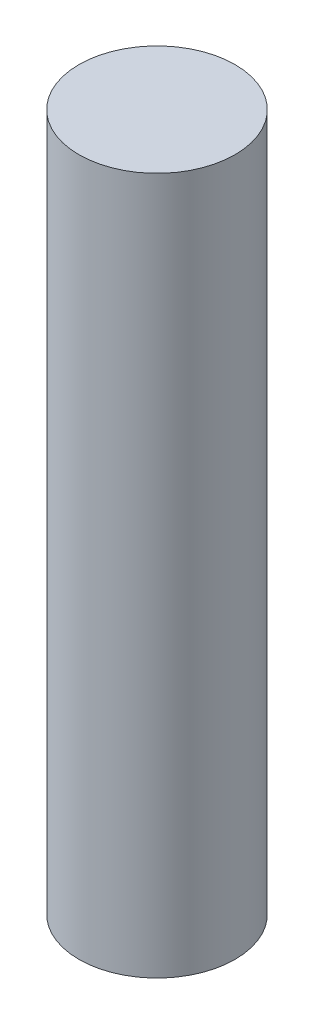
SolidWorks part; units mm, degrees
ref_plane "Front Plane" through (0, 0, 0) normal (0, 0, 1) x (1, 0, 0)
ref_plane "Top Plane" through (0, 0, 0) normal (0, 1, 0) x (1, 0, 0)
ref_plane "Right Plane" through (0, 0, 0) normal (1, 0, 0) x (0, 0, -1)
sketch "Sketch1" plane through (0, 0, 0) normal (0, 1, 0) x (1, 0, 0)
  circle A0 centre (0, 0) radius 1.4224
  dimension "D1" = 2.8448
extrude "Boss-Extrude1" add sketch "Sketch1" along normal blind 12.7
